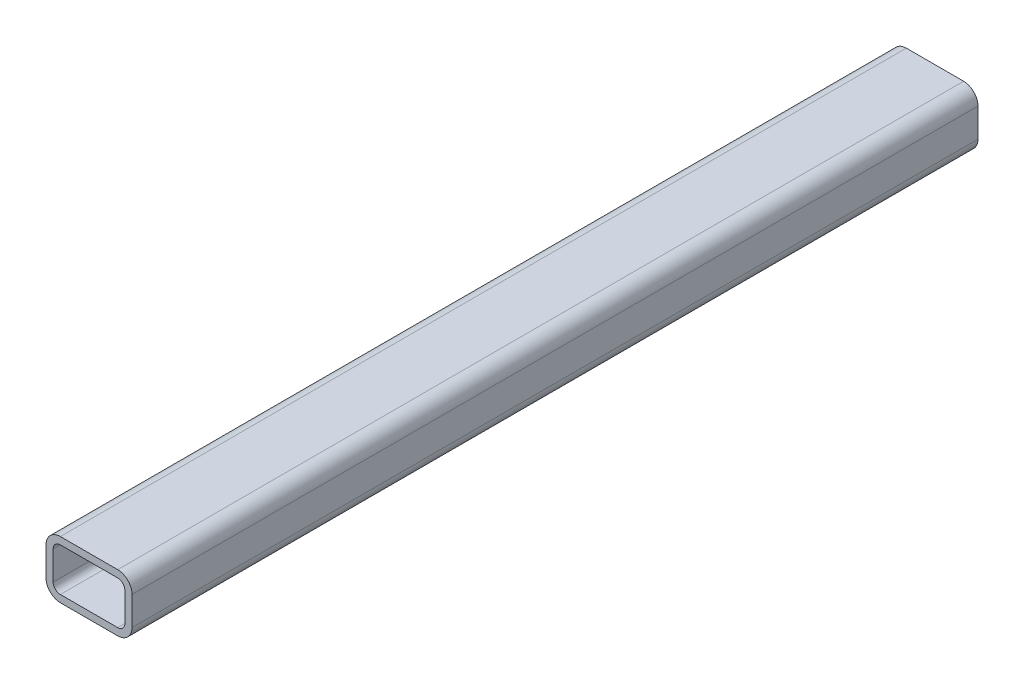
SolidWorks part; units mm, degrees
ref_plane "Front" through (0, 0, 0) normal (0, 0, 1) x (1, 0, 0)
ref_plane "Top" through (0, 0, 0) normal (0, 1, 0) x (1, 0, 0)
ref_plane "Right" through (0, 0, 0) normal (1, 0, 0) x (0, 0, -1)
sketch "Sketch1" plane through (0, 0, 0) normal (0, 0, 1) x (1, 0, 0)
  line L0 (-25.4, 25.4) -> (25.4, 25.4)
  line L1 (-38.1, 12.7) -> (-38.1, -12.7)
  line L2 (25.4, -25.4) -> (-25.4, -25.4)
  line L3 (38.1, -12.7) -> (38.1, 12.7)
  line L4 (0, -25.4) -> (0, 25.4) construction
  arc A0 (-38.1, 12.7) -> (-25.4, 25.4) centre (-25.4, 12.7) cw
  arc A1 (-25.4, -25.4) -> (-38.1, -12.7) centre (-25.4, -12.7) cw
  arc A2 (38.1, -12.7) -> (25.4, -25.4) centre (25.4, -12.7) cw
  arc A3 (38.1, 12.7) -> (25.4, 25.4) centre (25.4, 12.7) ccw
  dimension "D1" = 12.7
  dimension "D2" = 50.8
  dimension "D3" = 76.2
extrude "Base-Extrude-Thin" add sketch "Sketch1" along normal blind 749.3 thin
